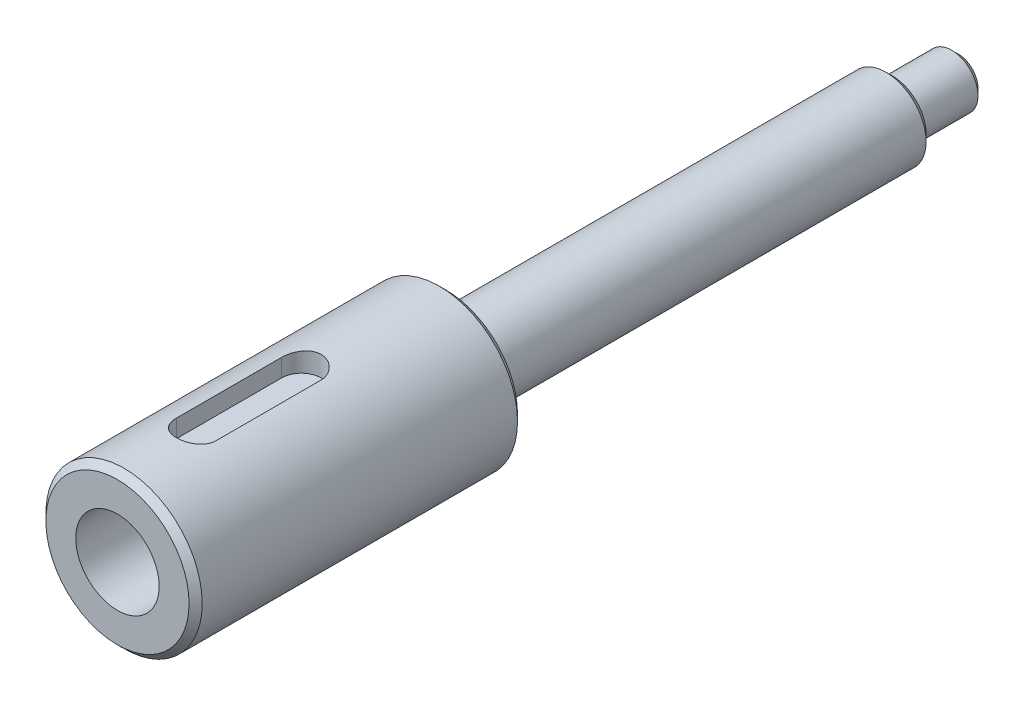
SolidWorks part; units mm, degrees
ref_plane "Plane1" through (0, 0, 0) normal (0, 0, 1) x (1, 0, 0)
ref_plane "Plane2" through (0, 0, 0) normal (0, 1, 0) x (1, 0, 0)
ref_plane "Plane3" through (0, 0, 0) normal (1, 0, 0) x (0, 0, -1)
sketch "Sketch1" plane through (0, 0, 0) normal (0, 0, 1) x (1, 0, 0)
  circle A2 centre (0, 0) radius 5.95
  dimension "D1" = 11.9
extrude "Base-Extrude" add sketch "Sketch1" along normal blind 25
sketch "Sketch3" plane through (0, 0, 0) normal (0, 0, -1) x (-1, 0, 0)
  circle A0 centre (0, 0) radius 3.05
  dimension "D1" = 6.1
extrude "Boss-Extrude1" add sketch "Sketch3" along normal blind 39
chamfer "Chamfer1" distance 0.5 angle 45
ref_plane "Plane4" through (0, 6, 0) normal (0, 1, 0) x (-1, 0, 0)
sketch "Sketch7" plane through (0, 6, 0) normal (0, 1, 0) x (-1, 0, 0)
  line L0 (0, 0) -> (0, 15) construction
  line L1 (5.95, 25) -> (-5.95, 25) construction
  line L2 (-1.5, 19) -> (-1.5, 11)
  line L4 (1.5, 19) -> (1.5, 11)
  arc A0 (1.5, 19) -> (-1.5, 19) centre (0, 19) ccw
  arc A1 (-1.5, 11) -> (1.5, 11) centre (0, 11) ccw
  dimension "D2" = 1.5
  dimension "D1" = 6
  dimension "D4" = 8
extrude "Cut-Extrude2" cut sketch "Sketch7" against normal blind 1.6
hole_wizard "M6.0 (6.000000) Diameter Hole1" positions "Sketch9" profile "Sketch8" hole size "M6.0" standard "ISO"
sketch "Sketch9" plane through (0, 0, 25) normal (0, 0, 1) x (1, 0, 0)
  point P0 (0, 0)
sketch "Sketch8" plane through (0, 0, 25) normal (1, 0, 0) x (0, -1, 0)
  line L0 (0, 0) -> (0, 23.4077)
  line L1 (0, 23.4077) -> (3.175, 21.5)
  line L2 (3.175, 21.5) -> (3.175, 0)
  line L5 (3.175, 0) -> (0, 0)
  line L10 (0, 23.4077) -> (-3.175, 21.5) construction
  line L11 (0, -6.35) -> (0, 107.95) construction
  dimension "Hole Dia." = 6.35
  dimension "Hole Depth" = 21.5
  dimension "Drill Angle" = 118
sketch "Sketch10" plane through (0, 0, -39) normal (0, 0, -1) x (-1, 0, 0)
  circle A0 centre (0, 0) radius 2
  circle A1 centre (0, 0) radius 3.05
  dimension "D1" = 4
  dimension "D2" = 6.1
extrude "Cut-Extrude3" cut sketch "Sketch10" against normal blind 5
chamfer "Chamfer2" distance 0.5 angle 45
sketch "Sketch11" plane through (0, 0, 0) normal (1, 0, 0) x (0, 0, -1)
  line L0 (-28.4596, 0) -> (48.9575, 0) construction
  line L1 (-25, 5.45) -> (-25, -5.45) construction
  circle A0 centre (-2.75, 0) radius 0.75
  dimension "D1" = 1.5
  dimension "D2" = 22.25
extrude "Cut-Extrude4" cut sketch "Sketch11" against normal blind 10
